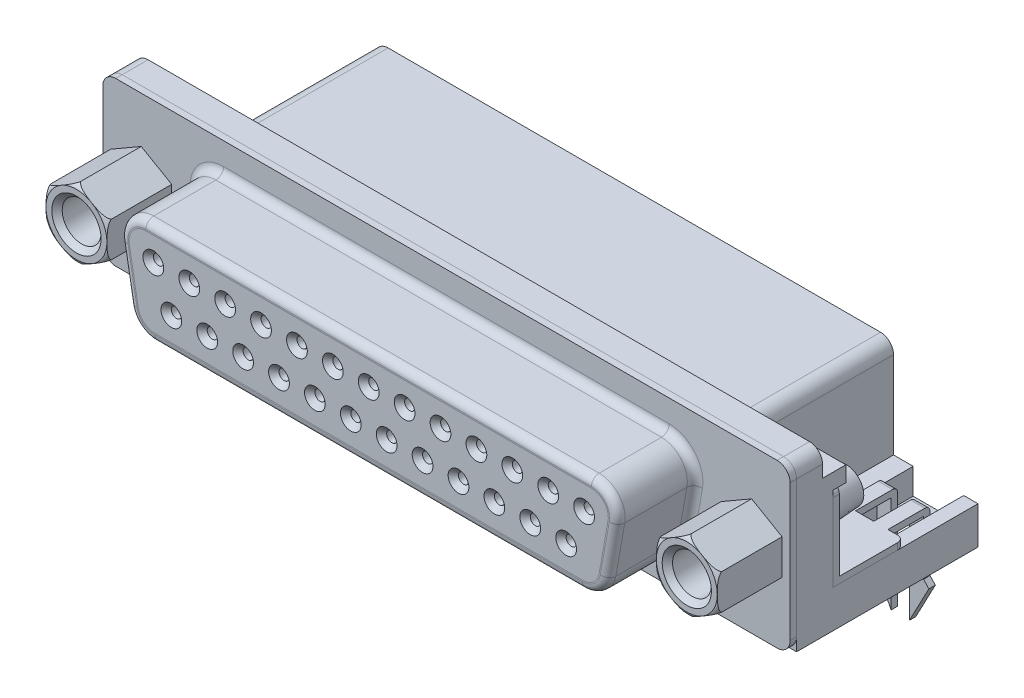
SolidWorks part; units mm, degrees
ref_plane "Alzado" through (0, 0, 0) normal (0, 0, 1) x (1, 0, 0)
ref_plane "Planta" through (0, 0, 0) normal (0, 1, 0) x (1, 0, 0)
ref_plane "Vista lateral" through (0, 0, 0) normal (1, 0, 0) x (0, 0, -1)
sketch "Croquis1" plane through (0, 0, 0) normal (0, 0, 1) x (1, 0, 0)
  line L1 (-25.52, 6.275) -> (25.52, 6.275)
  line L2 (-26.52, 5.275) -> (-26.52, -5.275)
  line L3 (-25.52, -6.275) -> (25.52, -6.275)
  line L4 (26.52, 5.275) -> (26.52, -5.275)
  arc A0 (25.52, 6.275) -> (26.52, 5.275) centre (25.52, 5.275) cw
  arc A1 (25.52, -6.275) -> (26.52, -5.275) centre (25.52, -5.275) ccw
  arc A2 (-25.52, 6.275) -> (-26.52, 5.275) centre (-25.52, 5.275) ccw
  arc A3 (-26.52, -5.275) -> (-25.52, -6.275) centre (-25.52, -5.275) ccw
  point P7 (26.52, 6.275)
  point P12 (-26.52, 6.275)
  dimension "D5" = 1
  dimension "D1" = 53.04
  dimension "D2" = 12.55
  dimension "D3" = 26.52
  dimension "D4" = 6.275
extrude "Extruir1" add sketch "Croquis1" along normal blind 0.5
sketch "Croquis2" plane through (0, 0, 0.5) normal (0, 0, 1) x (1, 0, 0)
  line L0 (19.1596, 1.6027) -> (18.4719, -2.2973)
  line L1 (-17.19, 3.95) -> (17.19, 3.95)
  line L2 (0, 0) -> (0, -16.7466) construction
  line L3 (-16.5023, -3.95) -> (16.5023, -3.95)
  line L4 (-19.1596, 1.6027) -> (-18.4719, -2.2973)
  arc A0 (19.1596, 1.6027) -> (17.19, 3.95) centre (17.19, 1.95) ccw
  arc A1 (-16.5023, -3.95) -> (-18.4719, -2.2973) centre (-16.5023, -1.95) cw
  arc A2 (-19.1596, 1.6027) -> (-17.19, 3.95) centre (-17.19, 1.95) cw
  arc A3 (16.5023, -3.95) -> (18.4719, -2.2973) centre (16.5023, -1.95) ccw
  dimension "D5" = 4
  dimension "D3" = 7.9
  dimension "D4" = 3.95
extrude "Extruir2" add sketch "Croquis2" along normal blind 6
sketch "Croquis3" plane through (0, 0, 6.5) normal (0, 0, 1) x (1, 0, 0)
  line L0 (17.19, 3.25) -> (-17.19, 3.25)
  line L1 (-18.4703, 1.7243) -> (-17.7826, -2.1757)
  line L2 (-16.5023, -3.25) -> (16.5023, -3.25)
  line L3 (17.7826, -2.1757) -> (18.4703, 1.7243)
  arc A0 (-17.19, 3.25) -> (-18.4703, 1.7243) centre (-17.19, 1.95) ccw
  arc A1 (-17.7826, -2.1757) -> (-16.5023, -3.25) centre (-16.5023, -1.95) ccw
  arc A2 (16.5023, -3.25) -> (17.7826, -2.1757) centre (16.5023, -1.95) ccw
  arc A3 (18.4703, 1.7243) -> (17.19, 3.25) centre (17.19, 1.95) ccw
extrude "Cortar-Extruir1" cut sketch "Croquis3" against normal blind 6
fillet "Redondeo1" radius 0.6 16 edges at (18.7221, 3.2356, 0.5) (18.8158, -0.3473, 0.5) (17.7879, -3.4821, 0.5) (0, -3.95, 0.5) (-17.7879, -3.4821, 0.5) (-18.8158, -0.3473, 0.5) (-18.7221, 3.2356, 0.5) (18.7221, 3.2356, 6.5) (18.8158, -0.3473, 6.5) (17.7879, -3.4821, 6.5) (0, -3.95, 6.5) (-17.7879, -3.4821, 6.5) (-18.8158, -0.3473, 6.5) (-18.7221, 3.2356, 6.5) (0, 3.95, 0.5) (0, 3.95, 6.5)
sketch "Croquis5" plane through (0, 0, 0.5) normal (0, 0, 1) x (1, 0, 0)
  line L4 (17.19, 3.25) -> (-17.19, 3.25)
  line L5 (-18.4703, 1.7243) -> (-17.7826, -2.1757)
  line L6 (-16.5023, -3.25) -> (16.5023, -3.25)
  line L7 (17.7826, -2.1757) -> (18.4703, 1.7243)
  line L8 (17.19, 3.25) -> (-17.19, 3.25)
  line L9 (-18.4703, 1.7243) -> (-17.7826, -2.1757)
  line L10 (-16.5023, -3.25) -> (16.5023, -3.25)
  line L11 (17.7826, -2.1757) -> (18.4703, 1.7243)
  circle A0 centre (16.625, 1.42) radius 0.4
  circle A1 centre (13.855, 1.42) radius 0.4
  circle A2 centre (11.085, 1.42) radius 0.4
  circle A3 centre (8.315, 1.42) radius 0.4
  arc A4 (18.4703, 1.7243) -> (17.19, 3.25) centre (17.19, 1.95) ccw
  arc A5 (-17.19, 3.25) -> (-18.4703, 1.7243) centre (-17.19, 1.95) ccw
  arc A6 (-17.7826, -2.1757) -> (-16.5023, -3.25) centre (-16.5023, -1.95) ccw
  arc A7 (16.5023, -3.25) -> (17.7826, -2.1757) centre (16.5023, -1.95) ccw
  arc A8 (18.4703, 1.7243) -> (17.19, 3.25) centre (17.19, 1.95) ccw
  arc A9 (-17.19, 3.25) -> (-18.4703, 1.7243) centre (-17.19, 1.95) ccw
  arc A10 (-17.7826, -2.1757) -> (-16.5023, -3.25) centre (-16.5023, -1.95) ccw
  arc A11 (16.5023, -3.25) -> (17.7826, -2.1757) centre (16.5023, -1.95) ccw
  circle A12 centre (5.545, 1.42) radius 0.4
  circle A13 centre (2.775, 1.42) radius 0.4
  circle A14 centre (0.005, 1.42) radius 0.4
  circle A15 centre (-2.765, 1.42) radius 0.4
  circle A16 centre (-5.535, 1.42) radius 0.4
  circle A17 centre (-8.305, 1.42) radius 0.4
  circle A18 centre (-11.075, 1.42) radius 0.4
  circle A19 centre (-13.845, 1.42) radius 0.4
  circle A20 centre (-16.615, 1.42) radius 0.4
  circle A21 centre (15.24, -1.42) radius 0.4
  circle A22 centre (12.47, -1.42) radius 0.4
  circle A23 centre (9.7, -1.42) radius 0.4
  circle A24 centre (6.93, -1.42) radius 0.4
  circle A25 centre (4.16, -1.42) radius 0.4
  circle A26 centre (1.39, -1.42) radius 0.4
  circle A27 centre (-1.38, -1.42) radius 0.4
  circle A28 centre (-4.15, -1.42) radius 0.4
  circle A29 centre (-6.92, -1.42) radius 0.4
  circle A30 centre (-9.69, -1.42) radius 0.4
  circle A31 centre (-12.46, -1.42) radius 0.4
  circle A32 centre (-15.23, -1.42) radius 0.4
  dimension "D2" = 0.8
  dimension "D3" = 16.625
  dimension "D4" = 1.42
  dimension "D1" = 0
extrude "Extruir3" add sketch "Croquis5" along normal blind 6 separate body
chamfer "Chaflán1" distance 0.4 angle 45 25 edges at (17.025, 1.42, 6.5) (14.255, 1.42, 6.5) (15.64, -1.42, 6.5) (12.87, -1.42, 6.5) (10.1, -1.42, 6.5) (11.485, 1.42, 6.5) (8.715, 1.42, 6.5) (5.945, 1.42, 6.5) (7.33, -1.42, 6.5) (4.56, -1.42, 6.5) (3.175, 1.42, 6.5) (0.405, 1.42, 6.5) (1.79, -1.42, 6.5) (-0.98, -1.42, 6.5) (-2.365, 1.42, 6.5) (-5.135, 1.42, 6.5) (-3.75, -1.42, 6.5) (-6.52, -1.42, 6.5) (-7.905, 1.42, 6.5) (-9.29, -1.42, 6.5) (-10.675, 1.42, 6.5) (-13.445, 1.42, 6.5) (-12.06, -1.42, 6.5) (-14.83, -1.42, 6.5) (-16.215, 1.42, 6.5)
sketch "Croquis6" plane through (0, 0, 0.5) normal (0, 0, 1) x (1, 0, 0)
  circle A0 centre (23.55, 0) radius 1.6
  circle A1 centre (-23.55, 0) radius 1.6
  dimension "D1" = 3.2
  dimension "D2" = 3.2
  dimension "D3" = 23.55
  dimension "D4" = 47.1
extrude "Cortar-Extruir2" cut sketch "Croquis6" against normal blind 6
sketch "Croquis7" plane through (0, 0, 0.5) normal (0, 0, 1) x (1, 0, 0)
  line L1 (23.55, 2.7135) -> (21.2, 1.3568)
  line L2 (21.2, 1.3568) -> (21.2, -1.3568)
  line L3 (21.2, -1.3568) -> (23.55, -2.7135)
  line L4 (23.55, -2.7135) -> (25.9, -1.3568)
  line L5 (25.9, -1.3568) -> (25.9, 1.3568)
  line L6 (25.9, 1.3568) -> (23.55, 2.7135)
  circle A0 centre (23.55, 0) radius 2.35 construction
extrude "Extruir4" add sketch "Croquis7" along normal blind 5 separate body
ref_plane "Plano1" through (23.55, 0, 0) normal (1, 0, 0) x (0, 0, -1)
sketch "Croquis8" plane through (23.55, 0, 0) normal (1, 0, 0) x (0, 0, -1)
  line L0 (-5.5, 1.3568) -> (-5.5, 2.7135) construction
  line L1 (-5.5, 2.7135) -> (-0.5, 2.7135) construction
  line L2 (-5.163, 2.7135) -> (-5.163, 5.0853)
  line L3 (-5.163, 5.0853) -> (-6.4864, 5.0853)
  line L4 (-6.4864, 5.0853) -> (-6.1878, 2.35)
  line L5 (-6.1878, 2.35) -> (-5.5, 2.35)
  line L6 (0, 0) -> (1.3514, 0) construction
  arc A0 (-5.5, 2.35) -> (-5.163, 2.7135) centre (-4.9764, 2.2026) cw
  dimension "D1" = 2.35
revolve "Cortar-Revolución1" cut sketch "Croquis8" angle 360 about L6
sketch "Croquis9" plane through (0, 0, 5.5) normal (0, 0, 1) x (1, 0, 0)
  circle A0 centre (23.55, 0) radius 1.5
  dimension "D1" = 3
extrude "Cortar-Extruir3" cut sketch "Croquis9" against normal blind 4
chamfer "Chaflán2" distance 0.4 angle 45 1 edges at (25.05, 0, 5.5)
mirror "Simetría1" about plane through (0, 0, 0) normal (1, 0, 0)
sketch "Croquis10" plane through (0, 0, 0) normal (0, 0, -1) x (-1, 0, 0)
  line L1 (-25.52, 6.275) -> (25.52, 6.275)
  line L2 (-26.52, 5.275) -> (-26.52, -6.275)
  line L3 (-26.52, -6.275) -> (26.52, -6.275)
  line L4 (26.52, 5.275) -> (26.52, -6.275)
  arc A0 (-25.52, 6.275) -> (-26.52, 5.275) centre (-25.52, 5.275) ccw
  arc A1 (25.52, 6.275) -> (26.52, 5.275) centre (25.52, 5.275) cw
  dimension "D1" = 1
extrude "Extruir5" add sketch "Croquis10" along normal blind 14 separate body
sketch "Croquis11" plane through (0, 0, -14) normal (0, 0, -1) x (-1, 0, 0)
  line L0 (30.0293, -3.375) -> (20, -3.375)
  line L1 (20, -3.375) -> (20, 4.325)
  line L2 (20, 4.325) -> (-20, 4.325)
  line L3 (-20, 4.325) -> (-20, -3.375)
  line L4 (-20, -3.375) -> (-30.6506, -3.375)
  line L5 (-30.6506, -3.375) -> (-30.6506, 10.8258)
  line L6 (-30.6506, 10.8258) -> (30.0293, 10.8258)
  line L7 (30.0293, 10.8258) -> (30.0293, -3.375)
  line L8 (-26.52, -6.275) -> (26.52, -6.275) construction
  dimension "D1" = 40
  dimension "D2" = 20
  dimension "D3" = 2.9
  dimension "D4" = 2.9
  dimension "D5" = 7.7
extrude "Cortar-Extruir4" cut sketch "Croquis11" against normal blind 12
fillet "Redondeo2" radius 1 2 edges at (-20, 4.325, -8) (20, 4.325, -8)
sketch "Croquis12" plane through (26.52, 0, 0) normal (1, 0, 0) x (0, 0, -1)
  line L0 (2, 4.325) -> (3.8, 4.325)
  line L1 (2, 4.325) -> (14, 4.325) construction
  line L2 (3.8, 4.325) -> (3.8, 3.125)
  line L3 (3.8, 3.125) -> (2.8, 3.125)
  line L4 (2.8, 3.125) -> (2.8, -3.375)
  line L5 (14, -3.375) -> (2, -3.375) construction
  line L6 (2.8, -3.375) -> (2, -3.375)
  line L7 (2, -3.375) -> (2, 4.325)
  dimension "D1" = 1.8
  dimension "D2" = 1
  dimension "D3" = 1.2
extrude "Extruir6" add sketch "Croquis12" against normal up to surface (53.04 mm away) separate body
combine bodies "Combinar1" operation type add bodies to combine 111 112
sketch "Croquis13" plane through (0, -3.375, 0) normal (0, 1, 0) x (-1, 0, 0)
  line L0 (-20, -2.8) -> (-26.52, -2.8) construction
  line L1 (-25.42, -2.8) -> (-21.52, -2.8)
  line L2 (-25.42, -2.8) -> (-25.42, -16.797)
  line L3 (-25.42, -16.797) -> (-21.52, -16.797)
  line L4 (-21.52, -2.8) -> (-21.52, -16.797)
  line L5 (-26.52, -14) -> (-26.52, -2.8) construction
  line L6 (0, 0) -> (0, -26.0275) construction
  line L7 (21.52, -2.8) -> (21.52, -16.797)
  line L8 (25.42, -16.797) -> (21.52, -16.797)
  line L9 (25.42, -2.8) -> (25.42, -16.797)
  line L10 (25.42, -2.8) -> (21.52, -2.8)
  dimension "D1" = 1.1
  dimension "D2" = 3.9
extrude "Cortar-Extruir5" cut sketch "Croquis13" against normal blind 2
sketch "Croquis14" plane through (0, -6.275, 0) normal (0, -1, 0) x (1, 0, 0)
  line L0 (21.52, -14) -> (25.42, -14) construction
  line L1 (19.75, -15.6683) -> (-19.75, -15.6683)
  line L2 (19.75, -15.6683) -> (19.75, -2)
  line L3 (19.75, -2) -> (-19.75, -2)
  line L4 (-19.75, -15.6683) -> (-19.75, -2)
  point P4 (23.47, -14)
  dimension "D1" = 39.5
  dimension "D2" = 12
  dimension "D3" = 19.75
extrude "Cortar-Extruir6" cut sketch "Croquis14" against normal blind 0.6
sketch "Croquis15" plane through (0, -5.675, 0) normal (0, -1, 0) x (1, 0, 0)
  line L0 (16.975, -12.35) -> (16.275, -12.35) construction
  line L1 (16.975, -12) -> (16.275, -12)
  line L2 (16.975, -12) -> (16.975, -12.7)
  line L3 (16.975, -12.7) -> (16.275, -12.7)
  line L4 (16.275, -12) -> (16.275, -12.7)
  line L5 (16.625, -12) -> (16.625, -12.7) construction
  line L6 (19.75, -14) -> (-19.75, -14) construction
  line L7 (14.205, -12) -> (13.505, -12)
  line L8 (14.205, -12) -> (14.205, -12.7)
  line L9 (14.205, -12.7) -> (13.505, -12.7)
  line L10 (13.505, -12) -> (13.505, -12.7)
  line L11 (14.205, -12.35) -> (13.505, -12.35) construction
  line L12 (13.855, -12) -> (13.855, -12.7) construction
  line L13 (11.435, -12) -> (10.735, -12)
  line L14 (11.435, -12) -> (11.435, -12.7)
  line L15 (11.435, -12.7) -> (10.735, -12.7)
  line L16 (10.735, -12) -> (10.735, -12.7)
  line L17 (11.435, -12.35) -> (10.735, -12.35) construction
  line L18 (11.085, -12) -> (11.085, -12.7) construction
  line L19 (8.665, -12) -> (7.965, -12)
  line L20 (8.665, -12) -> (8.665, -12.7)
  line L21 (8.665, -12.7) -> (7.965, -12.7)
  line L22 (7.965, -12) -> (7.965, -12.7)
  line L23 (8.665, -12.35) -> (7.965, -12.35) construction
  line L24 (8.315, -12) -> (8.315, -12.7) construction
  line L25 (5.895, -12) -> (5.195, -12)
  line L26 (5.895, -12) -> (5.895, -12.7)
  line L27 (5.895, -12.7) -> (5.195, -12.7)
  line L28 (5.195, -12) -> (5.195, -12.7)
  line L29 (5.895, -12.35) -> (5.195, -12.35) construction
  line L30 (5.545, -12) -> (5.545, -12.7) construction
  line L31 (3.125, -12) -> (2.425, -12)
  line L32 (3.125, -12) -> (3.125, -12.7)
  line L33 (3.125, -12.7) -> (2.425, -12.7)
  line L34 (2.425, -12) -> (2.425, -12.7)
  line L35 (3.125, -12.35) -> (2.425, -12.35) construction
  line L36 (2.775, -12) -> (2.775, -12.7) construction
  line L37 (0.355, -12) -> (-0.345, -12)
  line L38 (0.355, -12) -> (0.355, -12.7)
  line L39 (0.355, -12.7) -> (-0.345, -12.7)
  line L40 (-0.345, -12) -> (-0.345, -12.7)
  line L41 (0.355, -12.35) -> (-0.345, -12.35) construction
  line L42 (0.005, -12) -> (0.005, -12.7) construction
  line L43 (-2.415, -12) -> (-3.115, -12)
  line L44 (-2.415, -12) -> (-2.415, -12.7)
  line L45 (-2.415, -12.7) -> (-3.115, -12.7)
  line L46 (-3.115, -12) -> (-3.115, -12.7)
  line L47 (-2.415, -12.35) -> (-3.115, -12.35) construction
  line L48 (-2.765, -12) -> (-2.765, -12.7) construction
  line L49 (-5.185, -12) -> (-5.885, -12)
  line L50 (-5.185, -12) -> (-5.185, -12.7)
  line L51 (-5.185, -12.7) -> (-5.885, -12.7)
  line L52 (-5.885, -12) -> (-5.885, -12.7)
  line L53 (-5.185, -12.35) -> (-5.885, -12.35) construction
  line L54 (-5.535, -12) -> (-5.535, -12.7) construction
  line L55 (-7.955, -12) -> (-8.655, -12)
  line L56 (-7.955, -12) -> (-7.955, -12.7)
  line L57 (-7.955, -12.7) -> (-8.655, -12.7)
  line L58 (-8.655, -12) -> (-8.655, -12.7)
  line L59 (-7.955, -12.35) -> (-8.655, -12.35) construction
  line L60 (-8.305, -12) -> (-8.305, -12.7) construction
  line L61 (-10.725, -12) -> (-11.425, -12)
  line L62 (-10.725, -12) -> (-10.725, -12.7)
  line L63 (-10.725, -12.7) -> (-11.425, -12.7)
  line L64 (-11.425, -12) -> (-11.425, -12.7)
  line L65 (-10.725, -12.35) -> (-11.425, -12.35) construction
  line L66 (-11.075, -12) -> (-11.075, -12.7) construction
  line L67 (-13.495, -12) -> (-14.195, -12)
  line L68 (-13.495, -12) -> (-13.495, -12.7)
  line L69 (-13.495, -12.7) -> (-14.195, -12.7)
  line L70 (-14.195, -12) -> (-14.195, -12.7)
  line L71 (-13.495, -12.35) -> (-14.195, -12.35) construction
  line L72 (-13.845, -12) -> (-13.845, -12.7) construction
  line L73 (-16.265, -12) -> (-16.965, -12)
  line L74 (-16.265, -12) -> (-16.265, -12.7)
  line L75 (-16.265, -12.7) -> (-16.965, -12.7)
  line L76 (-16.965, -12) -> (-16.965, -12.7)
  line L77 (-16.265, -12.35) -> (-16.965, -12.35) construction
  line L78 (-16.615, -12) -> (-16.615, -12.7) construction
  line L79 (15.59, -9.86) -> (14.89, -9.86)
  line L80 (15.59, -9.16) -> (15.59, -9.86)
  line L81 (15.24, -9.16) -> (15.24, -9.86) construction
  line L82 (15.59, -9.51) -> (14.89, -9.51) construction
  line L83 (15.59, -9.16) -> (14.89, -9.16)
  line L84 (14.89, -9.16) -> (14.89, -9.86)
  line L85 (12.82, -9.86) -> (12.12, -9.86)
  line L86 (12.82, -9.16) -> (12.82, -9.86)
  line L87 (12.82, -9.16) -> (12.12, -9.16)
  line L88 (12.12, -9.16) -> (12.12, -9.86)
  line L89 (12.47, -9.16) -> (12.47, -9.86) construction
  line L90 (12.82, -9.51) -> (12.12, -9.51) construction
  line L91 (10.05, -9.86) -> (9.35, -9.86)
  line L92 (10.05, -9.16) -> (10.05, -9.86)
  line L93 (10.05, -9.16) -> (9.35, -9.16)
  line L94 (9.35, -9.16) -> (9.35, -9.86)
  line L95 (9.7, -9.16) -> (9.7, -9.86) construction
  line L96 (10.05, -9.51) -> (9.35, -9.51) construction
  line L97 (7.28, -9.86) -> (6.58, -9.86)
  line L98 (7.28, -9.16) -> (7.28, -9.86)
  line L99 (7.28, -9.16) -> (6.58, -9.16)
  line L100 (6.58, -9.16) -> (6.58, -9.86)
  line L101 (6.93, -9.16) -> (6.93, -9.86) construction
  line L102 (7.28, -9.51) -> (6.58, -9.51) construction
  line L103 (4.51, -9.86) -> (3.81, -9.86)
  line L104 (4.51, -9.16) -> (4.51, -9.86)
  line L105 (4.51, -9.16) -> (3.81, -9.16)
  line L106 (3.81, -9.16) -> (3.81, -9.86)
  line L107 (4.16, -9.16) -> (4.16, -9.86) construction
  line L108 (4.51, -9.51) -> (3.81, -9.51) construction
  line L109 (1.74, -9.86) -> (1.04, -9.86)
  line L110 (1.74, -9.16) -> (1.74, -9.86)
  line L111 (1.74, -9.16) -> (1.04, -9.16)
  line L112 (1.04, -9.16) -> (1.04, -9.86)
  line L113 (1.39, -9.16) -> (1.39, -9.86) construction
  line L114 (1.74, -9.51) -> (1.04, -9.51) construction
  line L115 (-1.03, -9.86) -> (-1.73, -9.86)
  line L116 (-1.03, -9.16) -> (-1.03, -9.86)
  line L117 (-1.03, -9.16) -> (-1.73, -9.16)
  line L118 (-1.73, -9.16) -> (-1.73, -9.86)
  line L119 (-1.38, -9.16) -> (-1.38, -9.86) construction
  line L120 (-1.03, -9.51) -> (-1.73, -9.51) construction
  line L121 (-3.8, -9.86) -> (-4.5, -9.86)
  line L122 (-3.8, -9.16) -> (-3.8, -9.86)
  line L123 (-3.8, -9.16) -> (-4.5, -9.16)
  line L124 (-4.5, -9.16) -> (-4.5, -9.86)
  line L125 (-4.15, -9.16) -> (-4.15, -9.86) construction
  line L126 (-3.8, -9.51) -> (-4.5, -9.51) construction
  line L127 (-6.57, -9.86) -> (-7.27, -9.86)
  line L128 (-6.57, -9.16) -> (-6.57, -9.86)
  line L129 (-6.57, -9.16) -> (-7.27, -9.16)
  line L130 (-7.27, -9.16) -> (-7.27, -9.86)
  line L131 (-6.92, -9.16) -> (-6.92, -9.86) construction
  line L132 (-6.57, -9.51) -> (-7.27, -9.51) construction
  line L133 (-9.34, -9.86) -> (-10.04, -9.86)
  line L134 (-9.34, -9.16) -> (-9.34, -9.86)
  line L135 (-9.34, -9.16) -> (-10.04, -9.16)
  line L136 (-10.04, -9.16) -> (-10.04, -9.86)
  line L137 (-9.69, -9.16) -> (-9.69, -9.86) construction
  line L138 (-9.34, -9.51) -> (-10.04, -9.51) construction
  line L139 (-12.11, -9.86) -> (-12.81, -9.86)
  line L140 (-12.11, -9.16) -> (-12.11, -9.86)
  line L141 (-12.11, -9.16) -> (-12.81, -9.16)
  line L142 (-12.81, -9.16) -> (-12.81, -9.86)
  line L143 (-12.46, -9.16) -> (-12.46, -9.86) construction
  line L144 (-12.11, -9.51) -> (-12.81, -9.51) construction
  line L145 (-14.88, -9.86) -> (-15.58, -9.86)
  line L146 (-14.88, -9.16) -> (-14.88, -9.86)
  line L147 (-14.88, -9.16) -> (-15.58, -9.16)
  line L148 (-15.58, -9.16) -> (-15.58, -9.86)
  line L149 (-15.23, -9.16) -> (-15.23, -9.86) construction
  line L150 (-14.88, -9.51) -> (-15.58, -9.51) construction
  dimension "D1" = 0.7
  dimension "D2" = 0.7
  dimension "D3" = 1.65
  dimension "D4" = 16.625
extrude "Extruir7" add sketch "Croquis15" along normal blind 4.4 and the other way blind 2 separate body
sketch "Croquis16" plane through (0, -5.675, 0) normal (0, -1, 0) x (1, 0, 0)
  line L0 (16.975, -12) -> (16.975, -16.0355)
  line L1 (16.975, -12) -> (16.275, -12)
  line L2 (16.275, -12) -> (16.275, -16.0355)
  line L3 (16.275, -16.0355) -> (16.975, -16.0355)
  line L4 (14.205, -12) -> (14.205, -16.0355)
  line L5 (15.59, -9.16) -> (14.89, -9.16)
  line L6 (15.59, -9.16) -> (15.59, -16.0355)
  line L7 (15.59, -16.0355) -> (14.89, -16.0355)
  line L8 (14.89, -9.16) -> (14.89, -16.0355)
  line L9 (14.205, -12) -> (13.505, -12)
  line L10 (13.505, -12) -> (13.505, -16.0355)
  line L11 (13.505, -16.0355) -> (14.205, -16.0355)
  line L12 (12.82, -9.16) -> (12.12, -9.16)
  line L13 (12.82, -9.16) -> (12.82, -16.0355)
  line L14 (12.82, -16.0355) -> (12.12, -16.0355)
  line L15 (12.12, -9.16) -> (12.12, -16.0355)
  line L16 (11.435, -12) -> (11.435, -16.0355)
  line L17 (11.435, -12) -> (10.735, -12)
  line L18 (10.735, -12) -> (10.735, -16.0355)
  line L19 (10.735, -16.0355) -> (11.435, -16.0355)
  line L20 (10.05, -9.16) -> (9.35, -9.16)
  line L21 (10.05, -9.16) -> (10.05, -16.0355)
  line L22 (10.05, -16.0355) -> (9.35, -16.0355)
  line L23 (9.35, -9.16) -> (9.35, -16.0355)
  line L24 (8.665, -12) -> (8.665, -16.0355)
  line L25 (8.665, -12) -> (7.965, -12)
  line L26 (7.965, -12) -> (7.965, -16.0355)
  line L27 (7.965, -16.0355) -> (8.665, -16.0355)
  line L28 (7.28, -9.16) -> (6.58, -9.16)
  line L29 (7.28, -9.16) -> (7.28, -16.0355)
  line L30 (7.28, -16.0355) -> (6.58, -16.0355)
  line L31 (6.58, -9.16) -> (6.58, -16.0355)
  line L32 (5.895, -12) -> (5.895, -16.0355)
  line L33 (5.895, -12) -> (5.195, -12)
  line L34 (5.195, -12) -> (5.195, -16.0355)
  line L35 (5.195, -16.0355) -> (5.895, -16.0355)
  line L36 (4.51, -9.16) -> (3.81, -9.16)
  line L37 (4.51, -9.16) -> (4.51, -16.0355)
  line L38 (4.51, -16.0355) -> (3.81, -16.0355)
  line L39 (3.81, -9.16) -> (3.81, -16.0355)
  line L40 (3.125, -12) -> (3.125, -16.0355)
  line L41 (3.125, -12) -> (2.425, -12)
  line L42 (2.425, -12) -> (2.425, -16.0355)
  line L43 (2.425, -16.0355) -> (3.125, -16.0355)
  line L44 (1.74, -9.16) -> (1.04, -9.16)
  line L45 (1.74, -9.16) -> (1.74, -16.0355)
  line L46 (1.74, -16.0355) -> (1.04, -16.0355)
  line L47 (1.04, -9.16) -> (1.04, -16.0355)
  line L48 (0.355, -12) -> (0.355, -16.0355)
  line L49 (0.355, -12) -> (-0.345, -12)
  line L50 (-0.345, -12) -> (-0.345, -16.0355)
  line L51 (-0.345, -16.0355) -> (0.355, -16.0355)
  line L52 (-1.03, -9.16) -> (-1.73, -9.16)
  line L53 (-1.03, -9.16) -> (-1.03, -16.0355)
  line L54 (-1.03, -16.0355) -> (-1.73, -16.0355)
  line L55 (-1.73, -9.16) -> (-1.73, -16.0355)
  line L56 (-2.415, -12) -> (-2.415, -16.0355)
  line L57 (-2.415, -12) -> (-3.115, -12)
  line L58 (-3.115, -12) -> (-3.115, -16.0355)
  line L59 (-3.115, -16.0355) -> (-2.415, -16.0355)
  line L60 (-3.8, -9.16) -> (-4.5, -9.16)
  line L61 (-3.8, -9.16) -> (-3.8, -16.0355)
  line L62 (-3.8, -16.0355) -> (-4.5, -16.0355)
  line L63 (-4.5, -9.16) -> (-4.5, -16.0355)
  line L64 (-5.185, -12) -> (-5.185, -16.0355)
  line L65 (-5.185, -12) -> (-5.885, -12)
  line L66 (-5.885, -12) -> (-5.885, -16.0355)
  line L67 (-5.885, -16.0355) -> (-5.185, -16.0355)
  line L68 (-6.57, -9.16) -> (-7.27, -9.16)
  line L69 (-6.57, -9.16) -> (-6.57, -16.0355)
  line L70 (-6.57, -16.0355) -> (-7.27, -16.0355)
  line L71 (-7.27, -9.16) -> (-7.27, -16.0355)
  line L72 (-7.955, -12) -> (-7.955, -16.0355)
  line L73 (-7.955, -12) -> (-8.655, -12)
  line L74 (-8.655, -12) -> (-8.655, -16.0355)
  line L75 (-8.655, -16.0355) -> (-7.955, -16.0355)
  line L76 (-9.34, -9.16) -> (-10.04, -9.16)
  line L77 (-9.34, -9.16) -> (-9.34, -16.0355)
  line L78 (-9.34, -16.0355) -> (-10.04, -16.0355)
  line L79 (-10.04, -9.16) -> (-10.04, -16.0355)
  line L80 (-10.725, -12) -> (-10.725, -16.0355)
  line L81 (-10.725, -12) -> (-11.425, -12)
  line L82 (-11.425, -12) -> (-11.425, -16.0355)
  line L83 (-11.425, -16.0355) -> (-10.725, -16.0355)
  line L84 (-12.11, -9.16) -> (-12.81, -9.16)
  line L85 (-12.11, -9.16) -> (-12.11, -16.0355)
  line L86 (-12.11, -16.0355) -> (-12.81, -16.0355)
  line L87 (-12.81, -9.16) -> (-12.81, -16.0355)
  line L88 (-13.495, -12) -> (-13.495, -16.0355)
  line L89 (-13.495, -12) -> (-14.195, -12)
  line L90 (-14.195, -12) -> (-14.195, -16.0355)
  line L91 (-14.195, -16.0355) -> (-13.495, -16.0355)
  line L92 (-14.88, -9.16) -> (-15.58, -9.16)
  line L93 (-14.88, -9.16) -> (-14.88, -16.0355)
  line L94 (-14.88, -16.0355) -> (-15.58, -16.0355)
  line L95 (-15.58, -9.16) -> (-15.58, -16.0355)
  line L97 (-16.265, -12) -> (-16.965, -12)
  line L98 (-16.265, -12) -> (-16.265, -16.0355)
  line L99 (-16.265, -16.0355) -> (-16.965, -16.0355)
  line L100 (-16.965, -12) -> (-16.965, -16.0355)
  dimension "D1" = 0.7
extrude "Cortar-Extruir7" cut sketch "Croquis16" against normal blind 2
sketch "Croquis17" plane through (0, -5.375, 0) normal (0, 1, 0) x (-1, 0, 0)
  line L0 (-25.42, -2.8) -> (-25.42, -14) construction
  line L1 (-21.52, -14) -> (-21.52, -2.8) construction
  line L2 (-21.52, -9.3) -> (-21.52, -11.3)
  line L3 (-25.42, -9.3) -> (-25.42, -11.3)
  line L4 (0, 0) -> (0, 17.0288) construction
  line L5 (25.42, -9.3) -> (25.42, -11.3)
  line L6 (21.52, -9.3) -> (21.52, -11.3)
  arc A0 (-25.42, -11.3) -> (-21.52, -11.3) centre (-23.47, -11.3) ccw
  arc A1 (21.52, -9.3) -> (25.42, -9.3) centre (23.47, -9.3) cw
  arc A2 (25.42, -11.3) -> (21.52, -11.3) centre (23.47, -11.3) cw
  arc A3 (-21.52, -9.3) -> (-25.42, -9.3) centre (-23.47, -9.3) ccw
  dimension "D1" = 11.8
extrude "Cortar-Extruir9" cut sketch "Croquis17" against normal blind 4
sketch "Croquis18" plane through (0, 0, -2.8) normal (0, 0, -1) x (-1, 0, 0)
  line L1 (-26.02, 3.125) -> (-21.0224, 3.125)
  line L2 (-26.52, 2.625) -> (-26.52, -3.375)
  line L3 (-26.52, -3.375) -> (-20.5224, -3.375)
  line L4 (-20.5224, 2.625) -> (-20.5224, -3.375)
  arc A0 (-26.02, 3.125) -> (-26.52, 2.625) centre (-26.02, 2.625) ccw
  arc A1 (-21.0224, 3.125) -> (-20.5224, 2.625) centre (-21.0224, 2.625) cw
  point P8 (-26.52, 3.125)
  dimension "D1" = 0.5
extrude "Extruir8" add sketch "Croquis18" along normal blind 0.5 separate body
sketch "Croquis19" plane through (0, -3.375, 0) normal (0, 1, 0) x (-1, 0, 0)
  line L0 (-26.52, -14) -> (-26.52, -2.8) construction
  line L1 (-20.5224, -3.3) -> (-26.52, -3.3)
  line L2 (-20.5224, -3.3) -> (-20.5224, -7.8)
  line L3 (-21.0224, -8.3) -> (-24.17, -8.3)
  line L4 (-26.52, -3.3) -> (-26.52, -7.8)
  line L5 (-25.27, -8.3) -> (-25.27, -11.55)
  line L6 (-25.27, -11.55) -> (-24.17, -11.55)
  line L7 (-24.17, -11.55) -> (-24.17, -8.3)
  line L8 (-24.17, -8.3) -> (-22.77, -8.3)
  line L9 (-22.77, -8.3) -> (-22.77, -11.55)
  line L10 (-22.77, -11.55) -> (-21.67, -11.55)
  line L11 (-21.67, -11.55) -> (-21.67, -8.3)
  line L12 (-25.52, 0.5) -> (-26.52, 0.5) construction
  line L13 (-21.52, -14) -> (-21.52, -2.8) construction
  line L14 (-25.42, -2.8) -> (-25.42, -14) construction
  line L15 (-25.27, -8.3) -> (-26.02, -8.3)
  line L16 (-21.67, -8.3) -> (-21.0224, -8.3)
  arc A0 (-26.02, -8.3) -> (-26.52, -7.8) centre (-26.02, -7.8) cw
  arc A1 (-20.5224, -7.8) -> (-21.0224, -8.3) centre (-21.0224, -7.8) cw
  point P9 (-26.52, -8.3)
  dimension "D2" = 0.5
  dimension "D1" = 5
  dimension "D3" = 12.05
  dimension "D4" = 0.15
  dimension "D5" = 0.15
  dimension "D6" = 1.1
  dimension "D7" = 1.1
extrude "Extruir9" add sketch "Croquis19" along normal blind 0.5 separate body contours A1 L2 L1 L15 L5 L6 L7 L3 M2 | A0 L15 L1 M2 M4 | L10 L11 L3 L9
combine bodies "Combinar2" operation type add bodies to combine 143 144
fillet "Redondeo3" radius 0.4 1 edges at (25.97, -3.375, -2.8)
sketch "Croquis20" plane through (0, 0, -11.55) normal (0, 0, -1) x (-1, 0, 0)
  line L0 (-25.27, -3.375) -> (-25.27, -7.5721)
  line L1 (-25.27, -7.5721) -> (-25.6775, -8.013)
  line L2 (-25.6775, -8.013) -> (-24.17, -10.875)
  line L3 (-24.17, -10.875) -> (-24.17, -3.375)
  line L4 (-25.27, -3.375) -> (-24.17, -3.375) construction
  line L5 (-24.17, -3.375) -> (-25.27, -3.375)
  line L6 (-25.27, -2.875) -> (-26.02, -2.875) construction
  line L7 (-23.47, -2.875) -> (-23.47, -7.5721) construction
  line L8 (-22.77, -2.875) -> (-24.17, -2.875) construction
  line L9 (-22.77, -3.375) -> (-21.67, -3.375)
  line L10 (-22.77, -10.875) -> (-22.77, -3.375)
  line L11 (-21.2625, -8.013) -> (-22.77, -10.875)
  line L12 (-21.67, -7.5721) -> (-21.2625, -8.013)
  line L13 (-21.67, -3.375) -> (-21.67, -7.5721)
  dimension "D1" = 8
extrude "Extruir10" add sketch "Croquis20" against normal blind 0.5 separate body
combine bodies "Combinar3" operation type add bodies to combine 146 147 145
fillet "Redondeo4" radius 0.4 2 edges at (22.22, -2.875, -11.55) (24.72, -2.875, -11.55)
sketch "Croquis21" plane through (0, 0, -3.3) normal (0, 0, -1) x (-1, 0, 0)
  circle A0 centre (-23.55, 0) radius 1.6
  dimension "D1" = 3.2
extrude "Extruir11" add sketch "Croquis21" along normal blind 3.5 draft 4 separate body
mirror "Simetría2" about plane through (0, 0, 0) normal (1, 0, 0)
sketch "Croquis22" plane through (0, 0, -14) normal (0, 0, -1) x (-1, 0, 0)
  line L0 (-18.4, 2.225) -> (18.4, 2.225)
  line L1 (-18.5, 2.325) -> (18.5, 2.325)
  line L2 (-18.5, 2.325) -> (-18.5, -3.675)
  line L3 (-18.5, -3.675) -> (18.5, -3.675)
  line L4 (18.5, 2.325) -> (18.5, -3.675)
  line L5 (18.4, 2.225) -> (18.4, -3.575)
  line L6 (-18.4, -3.575) -> (18.4, -3.575)
  line L7 (-18.4, 2.225) -> (-18.4, -3.575)
  dimension "D1" = 6
  dimension "D2" = 37
  dimension "D3" = 18.5
  dimension "D4" = 0.1
extrude "Cortar-Extruir10" cut sketch "Croquis22" against normal blind 6.5
